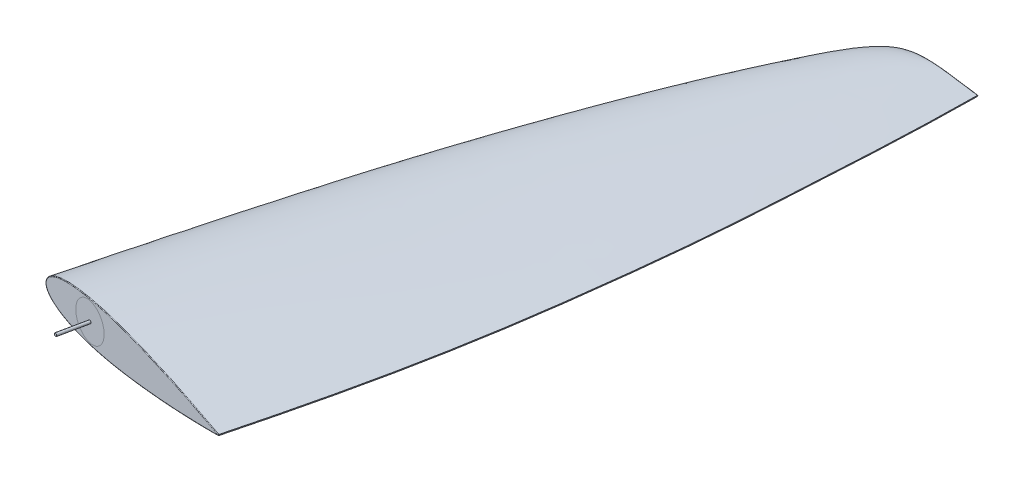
SolidWorks part; units mm, degrees
ref_plane "Front Plane" through (0, 0, 0) normal (0, 0, 1) x (1, 0, 0)
ref_plane "Top Plane" through (0, 0, 0) normal (0, 1, 0) x (1, 0, 0)
ref_plane "Right Plane" through (0, 0, 0) normal (1, 0, 0) x (0, 0, -1)
imported_body "Imported1"
imported_body "Imported2"
sketch "Sketch1" plane through (0, 0, 0) normal (0, 1, 0) x (1, 0, 0)
  line L0 (14229.6819, 234.0612) -> (14180.2952, -0.8152) construction
  line L1 (13900.4545, -1331.7004) -> (14229.6819, 234.0612) construction
  line L2 (14180.2952, -0.8152) -> (14185.1883, -1.8441)
  line L3 (14185.1883, -1.8441) -> (14208.1467, 107.3433)
  line L4 (14208.1467, 107.3433) -> (14203.2537, 108.3722)
  line L5 (14203.2537, 108.3722) -> (14180.2952, -0.8152)
  dimension "D1" = 100
  dimension "D2" = 10
delete or keep bodies "Body-Delete1" type delete bodies bodies 101
other "DeleteFace1"
mirror "Mirror1" about plane through (0, 0, 0) normal (0, 1, 0)
surface "Surface-Fill1"
surface "Surface-Knit1"
revolve "Revolve1" add sketch "Sketch1" angle 360 about L0
